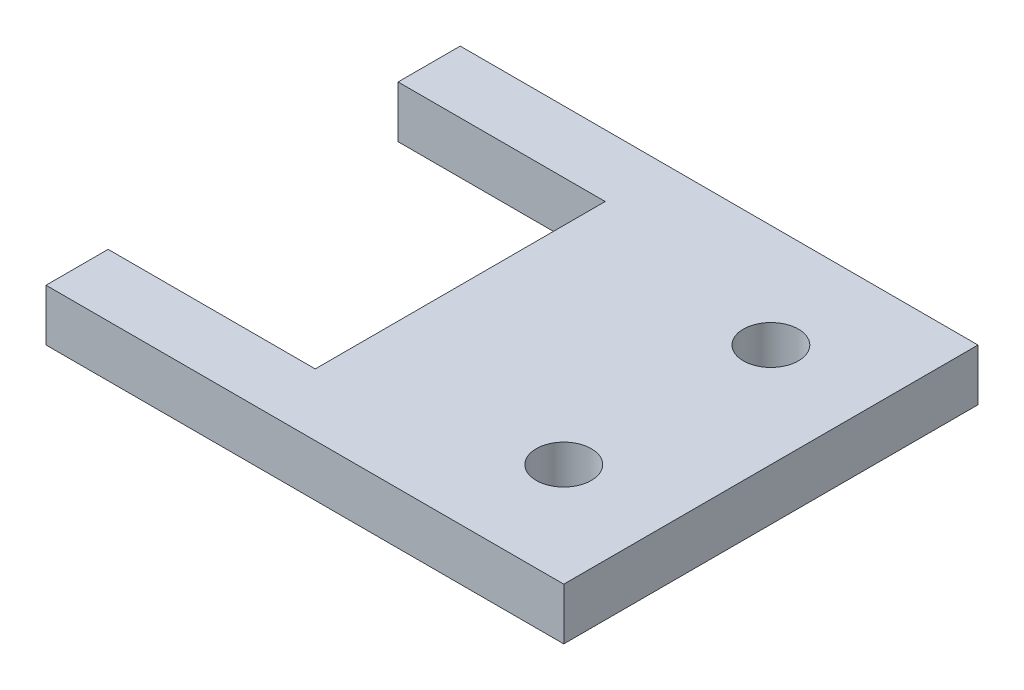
SolidWorks part; units mm, degrees
ref_plane "Front Plane" through (0, 0, 0) normal (0, 0, 1) x (1, 0, 0)
ref_plane "Top Plane" through (0, 0, 0) normal (0, 1, 0) x (1, 0, 0)
ref_plane "Right Plane" through (0, 0, 0) normal (1, 0, 0) x (0, 0, -1)
sketch "Sketch1" plane through (0, 0, 0) normal (0, 1, 0) x (1, 0, 0)
  line L1 (-54.5504, 25.0465) -> (8.9496, 25.0465)
  line L2 (-54.5504, 25.0465) -> (-54.5504, -25.7535)
  line L3 (-54.5504, -25.7535) -> (8.9496, -25.7535)
  line L4 (8.9496, 25.0465) -> (8.9496, -25.7535)
extrude "Boss-Extrude1" add sketch "Sketch1" along normal blind 6.35
sketch "Sketch2" plane through (0, 6.35, 0) normal (0, 1, 0) x (1, 0, 0)
  line L0 (-54.5504, 25.0465) -> (-54.5504, -25.7535) construction
  line L1 (-54.5504, 17.4265) -> (-29.1504, 17.4265)
  line L2 (-54.5504, 17.4265) -> (-54.5504, -18.1335)
  line L3 (-54.5504, -18.1335) -> (-29.1504, -18.1335)
  line L4 (-29.1504, 17.4265) -> (-29.1504, -18.1335)
  line L5 (8.9496, 25.0465) -> (-54.5504, 25.0465) construction
  dimension "D1" = 35.56
  dimension "D2" = 7.62
extrude "Cut-Extrude1" cut sketch "Sketch2" against normal blind 6.35
hole_wizard "H (0.266) Diameter Hole1" positions "Sketch3" profile "Sketch4" hole size "H" standard "ANSI Inch"
sketch "Sketch3" plane through (0, 6.35, 0) normal (0, 1, 0) x (1, 0, 0)
  line L0 (8.9496, -25.7535) -> (8.9496, 25.0465) construction
  line L1 (8.9496, 25.0465) -> (-54.5504, 25.0465) construction
  point P0 (-3.7504, 12.3465)
  point P2 (-3.7504, -13.0535)
  dimension "D1" = 25.4
  dimension "D2" = 12.7
  dimension "D3" = 12.7
sketch "Sketch4" plane through (-3.7504, 6.35, -12.3465) normal (1, 0, 0) x (0, 0, 1)
  line L0 (0, 0) -> (0, 6.35)
  line L1 (0, 6.35) -> (3.3782, 6.35)
  line L2 (3.3782, 6.35) -> (3.3782, 0)
  line L5 (3.3782, 0) -> (0, 0)
  line L11 (0, -6.35) -> (0, 107.95) construction
  dimension "Thru Hole Dia." = 6.7564
  dimension "Thru Hole Depth" = 6.35
